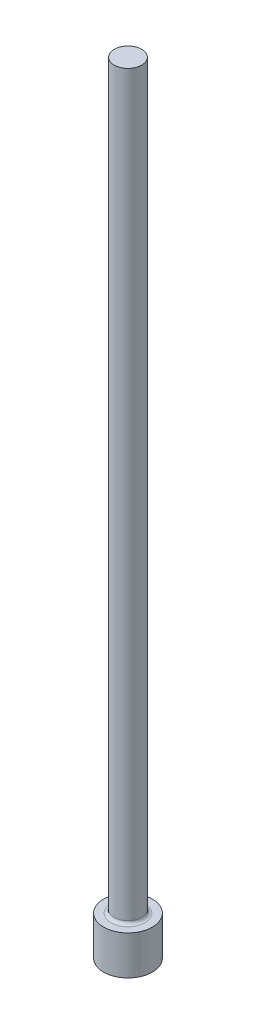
SolidWorks part; units mm, degrees
ref_plane "Front Plane" through (0, 0, 0) normal (0, 0, 1) x (1, 0, 0)
ref_plane "Top Plane" through (0, 0, 0) normal (0, 1, 0) x (1, 0, 0)
ref_plane "Right Plane" through (0, 0, 0) normal (1, 0, 0) x (0, 0, -1)
sketch "Sketch1" plane through (0, 0, 0) normal (0, 0, 1) x (1, 0, 0)
  line L0 (0, 0) -> (0, -1.906) construction
  line L1 (0, 0) -> (1.9812, 0)
  line L2 (1.9812, 0) -> (1.9812, 3.175)
  line L3 (1.9812, 3.175) -> (1.3716, 3.175)
  line L4 (1.1176, 3.429) -> (1.1176, 63.5)
  line L6 (0, 63.5) -> (1.1176, 63.5)
  line L7 (0, 63.5) -> (0, 0)
  arc A0 (1.3716, 3.175) -> (1.1176, 3.429) centre (1.3716, 3.429) cw
  dimension "D5" = 0.254
  dimension "D" = 2.2352
  dimension "H" = 3.9624
  dimension "D4" = 63.5
  dimension "T" = 3.175
revolve "Revolve3" add sketch "Sketch1" angle 360 about L0
